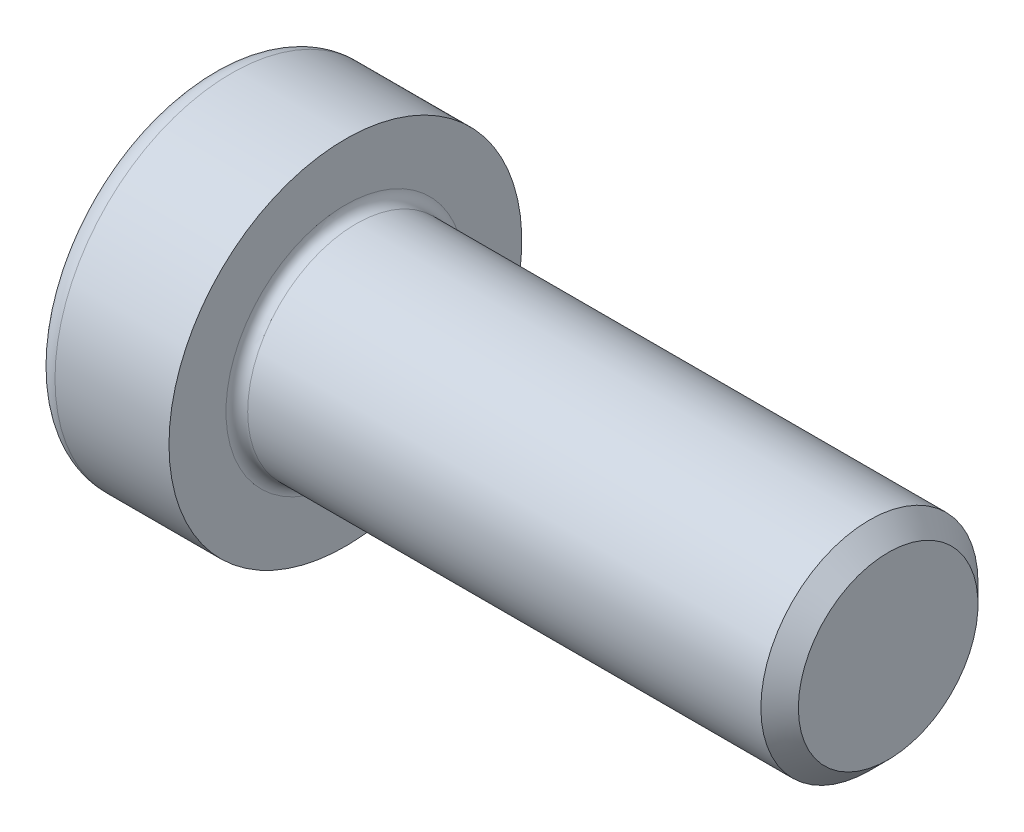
SolidWorks part; units mm, degrees
revolve "Base-Revolve" add sketch "BodySke" angle 360 about L6
sketch "BodySke" plane through (0, 0, 0) normal (0, 0, 1) x (1, 0, 0)
  line L0 (0, 0) -> (0, 6.5)
  line L1 (0, 6.5) -> (5, 6.5)
  line L2 (5, 6.5) -> (5, 4)
  line L3 (5, 4) -> (24.3095, 4)
  line L4 (25, 3.3095) -> (25, 0)
  line L5 (25, 0) -> (0, 0)
  line L6 (-31.75, 0) -> (127, 0) construction
  line L8 (25, 3.3095) -> (24.3095, 4)
  line L10 (25, -3.3095) -> (24.3095, -4) construction
  line L11 (6.25, 4.525) -> (6.25, -1.825) construction
  line L12 (8.75, 4.525) -> (8.75, -1.825) construction
  line L13 (-35, 4.525) -> (-35, -1.825) construction
  dimension "Diameter" = 8
  dimension "Head_ht" = 5
  dimension "Length" = 20
  dimension "Body_ch_ang" = 45
  dimension "Head_dia" = 13
  dimension "Minor_dia" = 6.619
  dimension "Advance" = 1.25
  dimension "Thread_nom" = 16.25
  dimension "Thread_length" = 60
fillet "Fillet2" radius 0.8 1 edges at (0, 0, 6.5)
ref_plane "Plane1" through (0, 0, 0) normal (0, 0, 1) x (1, 0, 0)
ref_plane "Plane2" through (0, 0, 0) normal (0, 1, 0) x (1, 0, 0)
ref_plane "Plane3" through (0, 0, 0) normal (1, 0, 0) x (0, 0, -1)
fillet "Fillet1" radius 0.4 1 edges at (5, 0, 4)
sketch "Sketch2" plane through (0, 0, 0) normal (0, 0, 1) x (1, 0, 0)
  line L0 (0, 2.5) -> (3.8, 2.5)
  line L1 (3.8, 2.5) -> (5.2434, 0)
  line L2 (-31.75, 0) -> (127, 0) construction
  line L3 (5.2434, 0) -> (0, 0)
  line L4 (0, 0) -> (0, 2.5)
  line L6 (0, 0) -> (47.625, 0) construction
revolve "Hex-PreBroach" cut sketch "Sketch2" angle 360 about L6
sketch "Sketch3" plane through (0, 0, 0) normal (-1, 0, 0) x (0, 0.5, 0.866)
  line L0 (1.4434, 2.5) -> (-1.4434, 2.5)
  line L1 (-1.4434, 2.5) -> (-2.8868, 0)
  line L2 (1.4434, 2.5) -> (2.8868, 0)
  line L3 (1.4434, -2.5) -> (2.8868, 0)
  line L4 (1.4434, -2.5) -> (-1.4434, -2.5)
  line L5 (-1.4434, -2.5) -> (-2.8868, 0)
extrude "Hex" cut sketch "Sketch3" against normal blind 3.8
sketch "ThdSchSke" plane through (0, 0, 0) normal (0, 0, 1) x (1, 0, 0)
  line L0 (8.75, -3.3095) -> (8.2665, -4)
  line L1 (8.75, -3.3095) -> (9.2335, -4)
  line L2 (9.2335, -4) -> (9.2335, -5)
  line L3 (-3.175, 0) -> (5.1513, 0) construction
  line L4 (0, 5.7) -> (0, -5.7) construction
  line L5 (9.2335, -5) -> (8.2665, -5)
  line L6 (8.2665, -5) -> (8.2665, -4)
revolve "ThreadSchematic" [suppressed] cut sketch "ThdSchSke" angle 360 about L3
pattern_linear "ThdSchPat" [suppressed]
thread "Filetage1" pitch 1.25 start angle 0, offset 5, length 21, pitch 1.25, diameter 8
ref_plane "Plan1" through (29.3095, 0, 4) normal (0, -1, 0) x (0, 0, 1)
sketch "Profil de filetage1" plane through (29.3095, 0, 4) normal (0, -1, 0) x (0, 0, 1)
  line L0 (0, 0) -> (0, 1.25) construction
  line L11 (0, 0) -> (0, 1.0937)
  line L12 (0, 1.0937) -> (-0.6766, 0.7031)
  line L13 (-0.6766, 0.7031) -> (-0.6766, 0.3906)
  line L15 (-0.6766, 0.3906) -> (0, 0)
  line L17 (-0.6766, 0.5469) -> (0, 0.5469) construction
  point P2 (0, 0)
  dimension "Pitch" = 1.25
  dimension "Profile_Angle" = 60
  dimension "Profile_Land" = 0.3125
  dimension "Profile_Height" = 0.6766
equation "\"D2@Sketch3\" = \"Hex_size@Sketch3\" / 2"
equation "\"D1@Sketch3\" = \"Hex_size@Sketch3\" / 2"
equation "\"D1@Sketch2\" = \"Hex_size@Sketch3\" / 2"
equation "\"Depth@Sketch2\" =  \"Key_eng@Hex\""
equation "\"Thread_minor@ThdSchSke\" = \"Minor_dia@BodySke\""
equation "\"Diameter@ThdSchSke\" = \"Diameter@BodySke\""
equation "\"Overcut@ThdSchSke\" = \"Diameter@BodySke\" * 1.25"
